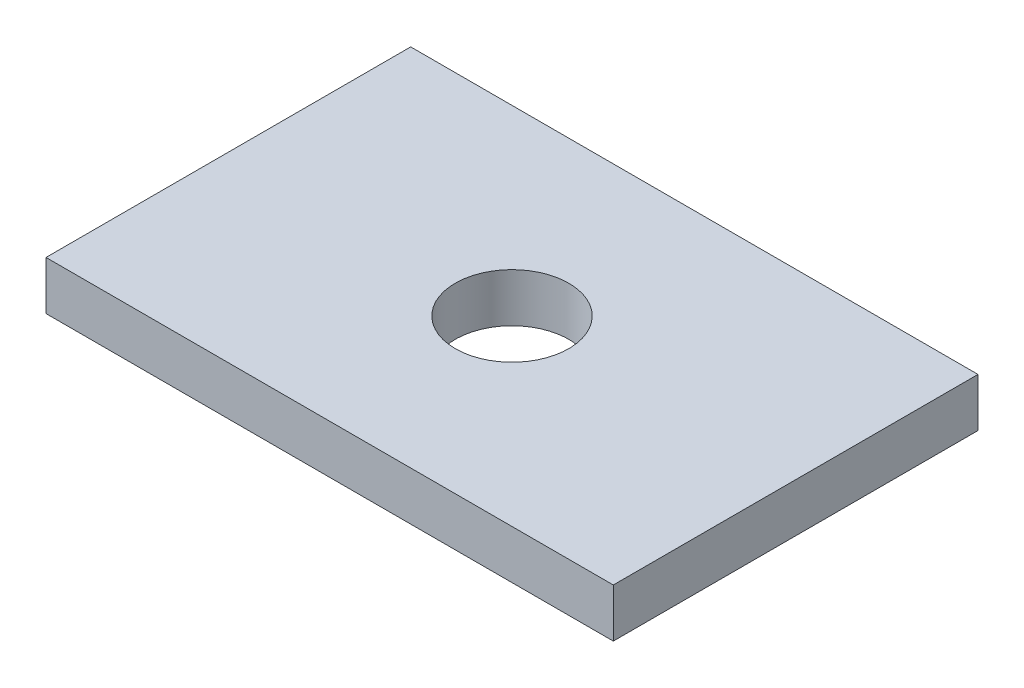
SolidWorks part; units mm, degrees
ref_plane "前视基准面" through (0, 0, 0) normal (0, 0, 1) x (1, 0, 0)
ref_plane "上视基准面" through (0, 0, 0) normal (0, 1, 0) x (1, 0, 0)
ref_plane "右视基准面" through (0, 0, 0) normal (1, 0, 0) x (0, 0, -1)
other "Configuration Table"
sketch "BaseSketch" plane through (0, 0, 0) normal (0, 1, 0) x (1, 0, 0)
  line L1 (0, 0) -> (140, 0)
  line L2 (0, 0) -> (0, 90)
  line L3 (0, 90) -> (140, 90)
  line L4 (140, 0) -> (140, 90)
  dimension "D1" = 140
  dimension "D2" = 90
extrude "BaseBoss" add sketch "BaseSketch" against normal blind 12
sketch "HoleSketch_1" plane through (0, 0, 0) normal (0, 1, 0) x (1, 0, 0)
  circle A0 centre (70, 45) radius 14
  dimension "D1" = 28
extrude "HoleCut_1" cut sketch "HoleSketch_1" against normal blind 12
